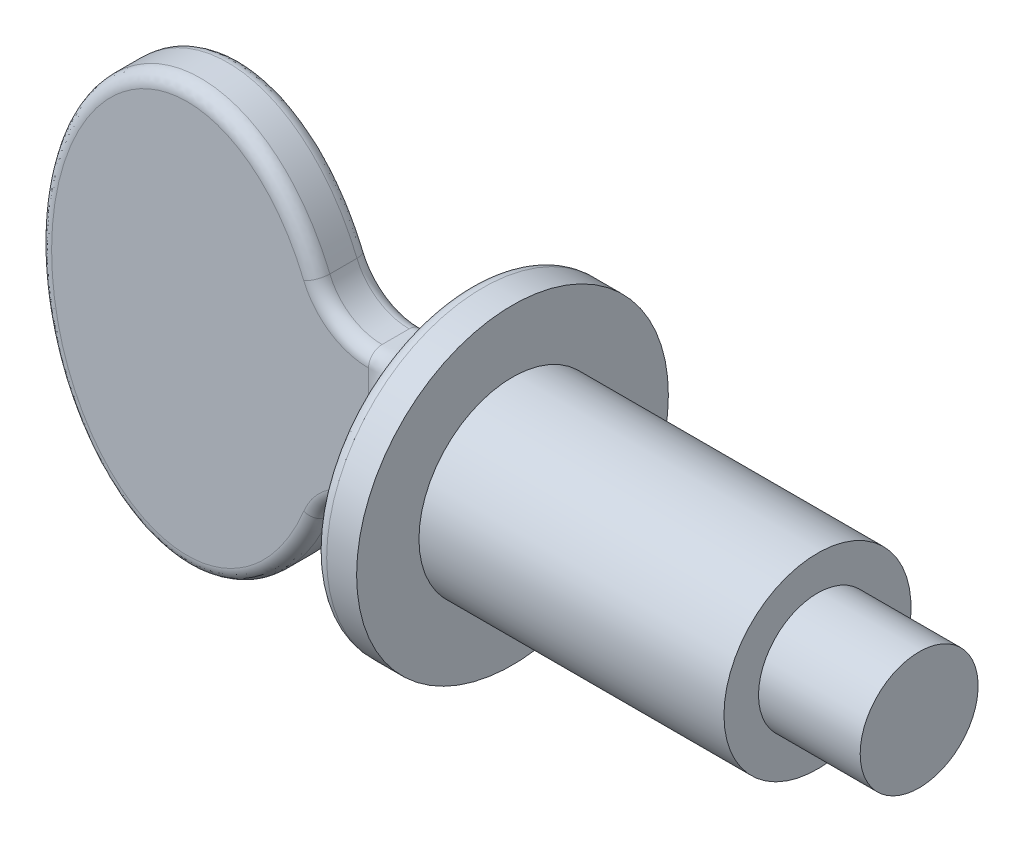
SolidWorks part; units mm, degrees
ref_plane "Front Plane" through (0, 0, 0) normal (0, 0, 1) x (1, 0, 0)
ref_plane "Top Plane" through (0, 0, 0) normal (0, 1, 0) x (1, 0, 0)
ref_plane "Right Plane" through (0, 0, 0) normal (1, 0, 0) x (0, 0, -1)
other "Configuration Table"
sketch "layout" plane through (0, 0, 0) normal (0, 0, 1) x (1, 0, 0)
  line L0 (0, 0) -> (13.208, 0) construction
  line L1 (5.588, 2.921) -> (5.588, -2.921)
  line L2 (3.3976, 1.3123) -> (4.8921, 1.3123) construction
  line L3 (5.588, 2.921) -> (4.7897, 2.921)
  line L4 (4.7897, 2.921) -> (4.7897, 3.2655) construction
  line L5 (4.2865, 1.706) -> (4.2865, 0)
  line L6 (4.2865, 1.706) -> (3.3355, 0.7551) construction
  line L7 (13.208, 1.7526) -> (13.208, 0)
  line L8 (3.3976, 1.3123) -> (3.3976, -1.3123)
  line L9 (13.208, 1.7526) -> (5.588, 1.7526)
  arc A0 (3.3976, 1.3123) -> (2.4197, 1.9685) centre (3.3976, 2.3692) cw
  arc A1 (4.7897, 2.921) -> (4.2865, 1.706) centre (3.0715, 2.921) cw
  arc A2 (3.3976, -1.3123) -> (2.4197, -1.9685) centre (3.3976, -2.3692) ccw
  ellipse E0 centre (0, 0) end of major axis (0, 3.937) minor radius 2.794 (2.4197, 1.9685) -> (2.4197, -1.9685) ccw
sketch "Sketch3" plane through (0, 0, 0) normal (0, 0, 1) x (1, 0, 0)
  line L0 (3.3976, 1.3123) -> (3.3976, -1.3123) construction
  line L1 (3.3976, 1.3123) -> (3.3976, -1.3123)
  arc A0 (3.3976, -1.3123) -> (2.4197, -1.9685) centre (3.3976, -2.3692) ccw construction
  arc A1 (2.4197, 1.9685) -> (3.3976, 1.3123) centre (3.3976, 2.3692) ccw construction
  arc A2 (3.3976, -1.3123) -> (2.4197, -1.9685) centre (3.3976, -2.3692) ccw
  arc A3 (2.4197, 1.9685) -> (3.3976, 1.3123) centre (3.3976, 2.3692) ccw
  ellipse E0 centre (0, 0) end of major axis (0, 3.937) minor radius 2.794 (2.4197, 1.9685) -> (2.4197, -1.9685) ccw construction
  ellipse E1 centre (0, 0) end of major axis (0, 3.937) minor radius 2.794 (2.4197, 1.9685) -> (2.4197, -1.9685) ccw
extrude "Extrude1" add sketch "Sketch3" along normal mid plane 1.016
fillet "Fillet1" radius 0.254 6 edges at (2.8088, 1.4916, -0.508) (2.8088, -1.4916, -0.508) (2.8088, 1.4916, 0.508) (2.8088, -1.4916, 0.508) (-2.794, 0, -0.508) (-2.794, 0, 0.508)
sketch "Sketch4" plane through (0, 0, 0) normal (0, 0, 1) x (1, 0, 0)
  line L0 (13.208, 1.7526) -> (13.208, 0) construction
  line L1 (13.208, 1.7526) -> (5.588, 1.7526) construction
  line L2 (5.588, 2.921) -> (5.588, -2.921) construction
  line L3 (5.588, 2.921) -> (4.7897, 2.921) construction
  line L4 (4.2865, 1.706) -> (4.2865, 0) construction
  line L5 (13.208, 1.1049) -> (13.208, 0)
  line L6 (11.303, 1.7526) -> (5.588, 1.7526)
  line L7 (5.588, 2.921) -> (5.588, 1.7526)
  line L8 (5.588, 2.921) -> (4.7897, 2.921)
  line L9 (4.2865, 1.706) -> (4.2865, 0)
  line L10 (0, 0) -> (16.8942, 0) construction
  line L11 (13.208, 0) -> (4.2865, 0)
  line L12 (13.208, 1.1049) -> (11.303, 1.1049)
  line L13 (11.303, 1.1049) -> (11.303, 1.7526)
  arc A0 (4.2865, 1.706) -> (4.7897, 2.921) centre (3.0715, 2.921) ccw construction
  arc A1 (4.2865, 1.706) -> (4.7897, 2.921) centre (3.0715, 2.921) ccw
revolve "Revolve1" add sketch "Sketch4" angle 360 about L10
loft "Loft1" add
fillet "Fillet2" radius 0.254 1 edges at (4.7897, 0, 2.921)
sketch "Sketch5" plane through (0, 0, 0) normal (0, 1, 0) x (1, 0, 0)
  line L0 (10.7575, 2.2981) -> (11.303, 2.2981)
  line L1 (11.303, 2.2981) -> (11.303, 1.7526)
  line L2 (11.303, 1.7526) -> (11.0302, 1.2802)
  line L3 (11.0302, 1.2802) -> (10.7575, 1.7526)
  line L5 (10.7575, 1.7526) -> (10.7575, 2.2981)
  line L6 (11.303, -1.7526) -> (11.303, 1.7526) construction
  line L7 (-3.6147, 0) -> (14.1406, 0) construction
  line L8 (11.303, 1.7526) -> (5.588, 1.7526) construction
revolve "Cut-Revolve10" [suppressed] cut sketch "Sketch5" angle 360 about L7
pattern_linear "LPattern10" [suppressed] count 7 along (1, 0, 0)
equation "\"D4@layout\" = \"Head Height@layout\" / 3 * 2"
equation "\"D5@layout\" = \"Head Width@layout\" / 3"
equation "\"D6@layout\" = \"Head Width@layout\" / 2"
equation "\"D7@layout\" = \"D5@layout\" * 1.3"
equation "\"D8@layout\" = \"D4@layout\"  / 7"
equation "\"D1@Fillet1\" = \"Head Thickness@Extrude1\" / 4"
equation "\"D1@Fillet2\" = \"D1@Fillet1\""
equation "\"D1@Sketch5\" = ( \"Base Screw Dia@layout\"- \"Minor Dia@Cosmetic Thread1\" )  / 2"
equation "\"D1@LPattern10\" = int((\"Length@layout\"-\"Q@Sketch4\")/\"Advance@LPattern10\")"
